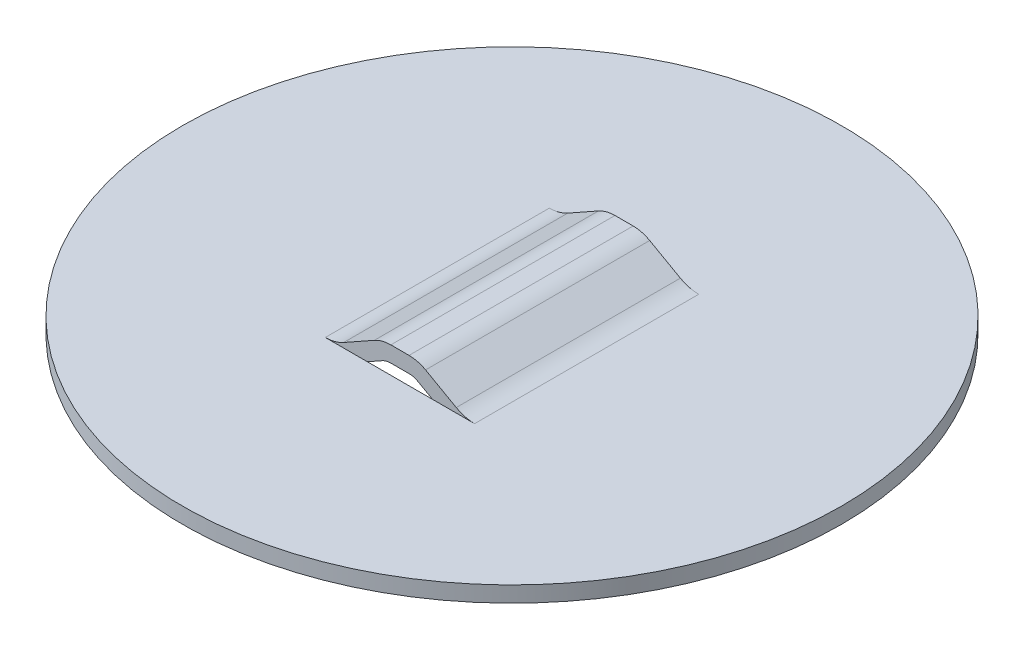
SolidWorks part; units mm, degrees
ref_plane "Front Plane" through (0, 0, 0) normal (0, 0, 1) x (1, 0, 0)
ref_plane "Top Plane" through (0, 0, 0) normal (0, 1, 0) x (1, 0, 0)
ref_plane "Right Plane" through (0, 0, 0) normal (1, 0, 0) x (0, 0, -1)
sketch "Sketch1" plane through (0, 0, 0) normal (0, 0, 1) x (1, 0, 0)
  line L0 (0, 0.508) -> (0.4382, 0.508)
  line L1 (0.8612, 0.3973) -> (2.3396, -0.4332)
  line L2 (0, 1.27) -> (0.4382, 1.27)
  line L3 (1.2344, 1.0617) -> (2.7128, 0.2311)
  line L4 (3.5961, 0) -> (6.4143, 0)
  line L5 (0, 1.27) -> (0, -2.8454) construction
  line L6 (3.5961, -0.762) -> (6.4143, -0.762)
  line L7 (-3.5961, -0.762) -> (-6.4143, -0.762)
  line L8 (-3.5961, 0) -> (-6.4143, 0)
  line L9 (-1.2344, 1.0617) -> (-2.7128, 0.2311)
  line L10 (0, 1.27) -> (-0.4382, 1.27)
  line L11 (-0.8612, 0.3973) -> (-2.3396, -0.4332)
  line L12 (0, 0.508) -> (-0.4382, 0.508)
  line L13 (-6.4143, 0) -> (-6.4143, -0.762)
  line L14 (6.4143, 0) -> (6.4143, -0.762)
  arc A0 (0.4382, 1.27) -> (1.2344, 1.0617) centre (0.4382, -0.3556) cw
  arc A1 (0.4382, 0.508) -> (0.8612, 0.3973) centre (0.4382, -0.3556) cw
  arc A2 (2.3396, -0.4332) -> (3.5961, -0.762) centre (3.5961, 1.8034) ccw
  arc A3 (2.7128, 0.2311) -> (3.5961, 0) centre (3.5961, 1.8034) ccw
  arc A4 (-2.7128, 0.2311) -> (-3.5961, 0) centre (-3.5961, 1.8034) cw
  arc A5 (-2.3396, -0.4332) -> (-3.5961, -0.762) centre (-3.5961, 1.8034) cw
  arc A6 (-0.4382, 0.508) -> (-0.8612, 0.3973) centre (-0.4382, -0.3556) ccw
  arc A7 (-0.4382, 1.27) -> (-1.2344, 1.0617) centre (-0.4382, -0.3556) ccw
  point P0 (-0.8636, 1.27)
  point P12 (0.8636, 1.27)
  point P17 (-3.1242, 0)
  point P20 (3.1242, 0)
  dimension "D4" = 1.6256
  dimension "D3" = 0.762
  dimension "D1" = 1.27
  dimension "D2" = 6.2484
extrude "Boss-Extrude1" add sketch "Sketch1" along normal blind 10.795
sketch "Sketch3" plane through (0, 0, 10.795) normal (0, 0, 1) x (1, 0, 0)
  line L12 (0.8612, 0.3973) -> (2.3396, -0.4332)
  line L13 (3.5961, -0.762) -> (6.4143, -0.762)
  line L14 (6.4143, -0.762) -> (6.4143, 0)
  line L15 (6.4143, 0) -> (3.5961, 0)
  line L16 (2.7128, 0.2311) -> (1.2344, 1.0617)
  line L17 (0.4382, 1.27) -> (-0.4382, 1.27)
  line L18 (-1.2344, 1.0617) -> (-2.7128, 0.2311)
  line L19 (-3.5961, 0) -> (-6.4143, 0)
  line L20 (-6.4143, 0) -> (-6.4143, -0.762)
  line L21 (-6.4143, -0.762) -> (-3.5961, -0.762)
  line L22 (-2.3396, -0.4332) -> (-0.8612, 0.3973)
  line L23 (-0.4382, 0.508) -> (0.4382, 0.508)
  line L24 (0.8612, 0.3973) -> (2.3396, -0.4332)
  line L25 (3.5961, -0.762) -> (6.4143, -0.762)
  line L26 (6.4143, -0.762) -> (6.4143, 0)
  line L27 (6.4143, 0) -> (3.5961, 0)
  line L28 (2.7128, 0.2311) -> (1.2344, 1.0617)
  line L29 (0.4382, 1.27) -> (-0.4382, 1.27)
  line L30 (-1.2344, 1.0617) -> (-2.7128, 0.2311)
  line L31 (-3.5961, 0) -> (-6.4143, 0)
  line L32 (-6.4143, 0) -> (-6.4143, -0.762)
  line L33 (-6.4143, -0.762) -> (-3.5961, -0.762)
  line L34 (-2.3396, -0.4332) -> (-0.8612, 0.3973)
  line L35 (-0.4382, 0.508) -> (0.4382, 0.508)
  arc A8 (0.8612, 0.3973) -> (0.4382, 0.508) centre (0.4382, -0.3556) ccw
  arc A9 (2.3396, -0.4332) -> (3.5961, -0.762) centre (3.5961, 1.8034) ccw
  arc A10 (2.7128, 0.2311) -> (3.5961, 0) centre (3.5961, 1.8034) ccw
  arc A11 (1.2344, 1.0617) -> (0.4382, 1.27) centre (0.4382, -0.3556) ccw
  arc A12 (-0.4382, 1.27) -> (-1.2344, 1.0617) centre (-0.4382, -0.3556) ccw
  arc A13 (-3.5961, 0) -> (-2.7128, 0.2311) centre (-3.5961, 1.8034) ccw
  arc A14 (-3.5961, -0.762) -> (-2.3396, -0.4332) centre (-3.5961, 1.8034) ccw
  arc A15 (-0.4382, 0.508) -> (-0.8612, 0.3973) centre (-0.4382, -0.3556) ccw
  arc A16 (0.8612, 0.3973) -> (0.4382, 0.508) centre (0.4382, -0.3556) ccw
  arc A17 (2.3396, -0.4332) -> (3.5961, -0.762) centre (3.5961, 1.8034) ccw
  arc A18 (2.7128, 0.2311) -> (3.5961, 0) centre (3.5961, 1.8034) ccw
  arc A19 (1.2344, 1.0617) -> (0.4382, 1.27) centre (0.4382, -0.3556) ccw
  arc A20 (-0.4382, 1.27) -> (-1.2344, 1.0617) centre (-0.4382, -0.3556) ccw
  arc A21 (-3.5961, 0) -> (-2.7128, 0.2311) centre (-3.5961, 1.8034) ccw
  arc A22 (-3.5961, -0.762) -> (-2.3396, -0.4332) centre (-3.5961, 1.8034) ccw
  arc A23 (-0.4382, 0.508) -> (-0.8612, 0.3973) centre (-0.4382, -0.3556) ccw
  dimension "D1" = 0
sketch "Sketch2" plane through (0, -0.762, 0) normal (0, -1, 0) x (1, 0, 0)
  line L0 (0, 0) -> (0, 10.795) construction
  line L1 (-0.4382, 10.795) -> (0.4382, 10.795) construction
  circle A0 centre (0, 5.3975) radius 15.875
  dimension "D1" = 31.75
extrude "Boss-Extrude2" add sketch "Sketch2" against normal up to vertex
sketch "Sketch4" plane through (0, 0, 10.795) normal (0, 0, 1) x (1, 0, 0)
  line L0 (-3.5961, -0.762) -> (3.5961, -0.762)
  line L12 (-6.4143, 0) -> (-6.4143, -0.762)
  line L13 (-6.4143, -0.762) -> (-3.5961, -0.762)
  line L14 (-2.3396, -0.4332) -> (-0.8612, 0.3973)
  line L15 (-0.4382, 0.508) -> (0.4382, 0.508)
  line L16 (0.8612, 0.3973) -> (2.3396, -0.4332)
  line L17 (3.5961, -0.762) -> (6.4143, -0.762)
  line L18 (6.4143, -0.762) -> (6.4143, 0)
  line L19 (6.4143, 0) -> (3.5961, 0)
  line L20 (2.7128, 0.2311) -> (1.2344, 1.0617)
  line L21 (0.4382, 1.27) -> (-0.4382, 1.27)
  line L22 (-1.2344, 1.0617) -> (-2.7128, 0.2311)
  line L23 (-3.5961, 0) -> (-6.4143, 0)
  line L26 (-2.3396, -0.4332) -> (-0.8612, 0.3973)
  line L27 (-0.4382, 0.508) -> (0.4382, 0.508)
  line L28 (0.8612, 0.3973) -> (2.3396, -0.4332)
  arc A8 (-3.5961, -0.762) -> (-2.3396, -0.4332) centre (-3.5961, 1.8034) ccw
  arc A9 (-0.4382, 0.508) -> (-0.8612, 0.3973) centre (-0.4382, -0.3556) ccw
  arc A10 (0.8612, 0.3973) -> (0.4382, 0.508) centre (0.4382, -0.3556) ccw
  arc A11 (2.3396, -0.4332) -> (3.5961, -0.762) centre (3.5961, 1.8034) ccw
  arc A12 (2.7128, 0.2311) -> (3.5961, 0) centre (3.5961, 1.8034) ccw
  arc A13 (1.2344, 1.0617) -> (0.4382, 1.27) centre (0.4382, -0.3556) ccw
  arc A14 (-0.4382, 1.27) -> (-1.2344, 1.0617) centre (-0.4382, -0.3556) ccw
  arc A15 (-3.5961, 0) -> (-2.7128, 0.2311) centre (-3.5961, 1.8034) ccw
  arc A16 (-3.5961, -0.762) -> (-2.3396, -0.4332) centre (-3.5961, 1.8034) ccw
  arc A17 (-0.4382, 0.508) -> (-0.8612, 0.3973) centre (-0.4382, -0.3556) ccw
  arc A18 (0.8612, 0.3973) -> (0.4382, 0.508) centre (0.4382, -0.3556) ccw
  arc A19 (2.3396, -0.4332) -> (3.5961, -0.762) centre (3.5961, 1.8034) ccw
  dimension "D1" = 0
extrude "Cut-Extrude1" cut sketch "Sketch4" against normal up to vertex (10.795 mm away)
